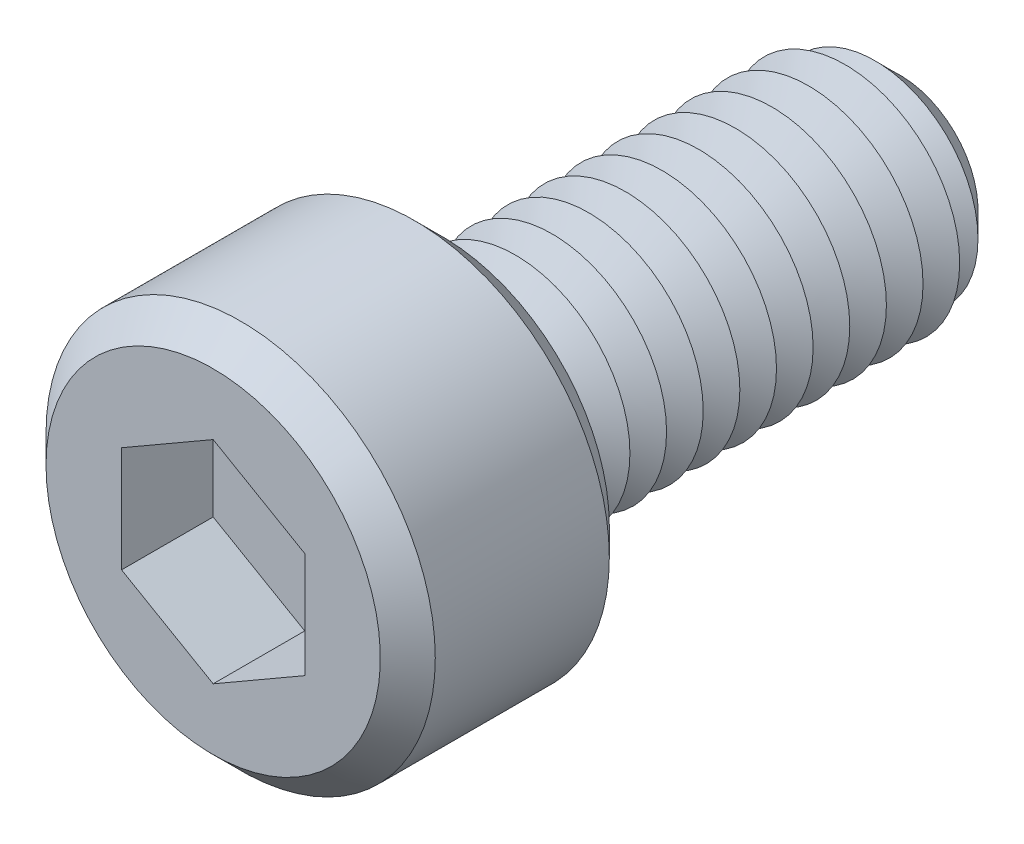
SolidWorks part; units mm, degrees
ref_plane "Front Plane" through (0, 0, 0) normal (0, 0, 1) x (1, 0, 0)
ref_plane "Top Plane" through (0, 0, 0) normal (0, 1, 0) x (1, 0, 0)
ref_plane "Right Plane" through (0, 0, 0) normal (1, 0, 0) x (0, 0, -1)
sketch "Sketch1" plane through (0, 0, 0) normal (0, 0, 1) x (1, 0, 0)
  circle A0 centre (0, 0) radius 4.25
  dimension "D1" = 8.5
extrude "Boss-Extrude1" add sketch "Sketch1" along normal blind 5
sketch "Sketch2" plane through (0, 0, 0) normal (0, 0, -1) x (-1, 0, 0)
  circle A0 centre (0, 0) radius 2.5
  dimension "D1" = 5
extrude "Boss-Extrude2" add sketch "Sketch2" along normal blind 10
chamfer "Chamfer1" distance 0.8 angle 45 1 edges at (-2.5, 0, -10)
sketch "Sketch3" plane through (0, 0, 0) normal (1, 0, 0) x (0, 0, -1)
  line L0 (-2.5121, 0) -> (4.5776, 0) construction
sketch "Sketch4" plane through (0, 0, 0) normal (1, 0, 0) x (0, 0, -1)
  line L0 (0, 2.5) -> (0.4, 1.8072)
  line L1 (0.4, 1.8072) -> (0.8, 2.5)
  line L2 (9.2, 2.5) -> (0, 2.5) construction
  line L3 (0.8, 2.5) -> (0, 2.5)
  dimension "D1" = 0.8
revolve "Cut-Revolve1" cut sketch "Sketch4" angle 360 about L0
pattern_linear "LPattern1" count 12 spacing 0.8 along (0, 0, -1) of "Cut-Revolve1"
sketch "Sketch5" plane through (0, 0, 5) normal (0, 0, 1) x (1, 0, 0)
  line L1 (0, 2.3094) -> (-2, 1.1547)
  line L2 (-2, 1.1547) -> (-2, -1.1547)
  line L3 (-2, -1.1547) -> (0, -2.3094)
  line L4 (0, -2.3094) -> (2, -1.1547)
  line L5 (2, -1.1547) -> (2, 1.1547)
  line L6 (2, 1.1547) -> (0, 2.3094)
  circle A0 centre (0, 0) radius 2 construction
  dimension "D1" = 4
extrude "Cut-Extrude1" cut sketch "Sketch5" against normal blind 2
sketch "Sketch6" plane through (0, 0, 3) normal (0, 0, 1) x (1, 0, 0)
  circle A0 centre (0, 0) radius 0.65
  dimension "D1" = 1.3
extrude "Cut-Extrude2" cut sketch "Sketch6" against normal up to surface (13 mm away)
chamfer "Chamfer2" distance 0.6 angle 45 2 edges at (4.25, 0, 0) (4.25, 0, 5)
